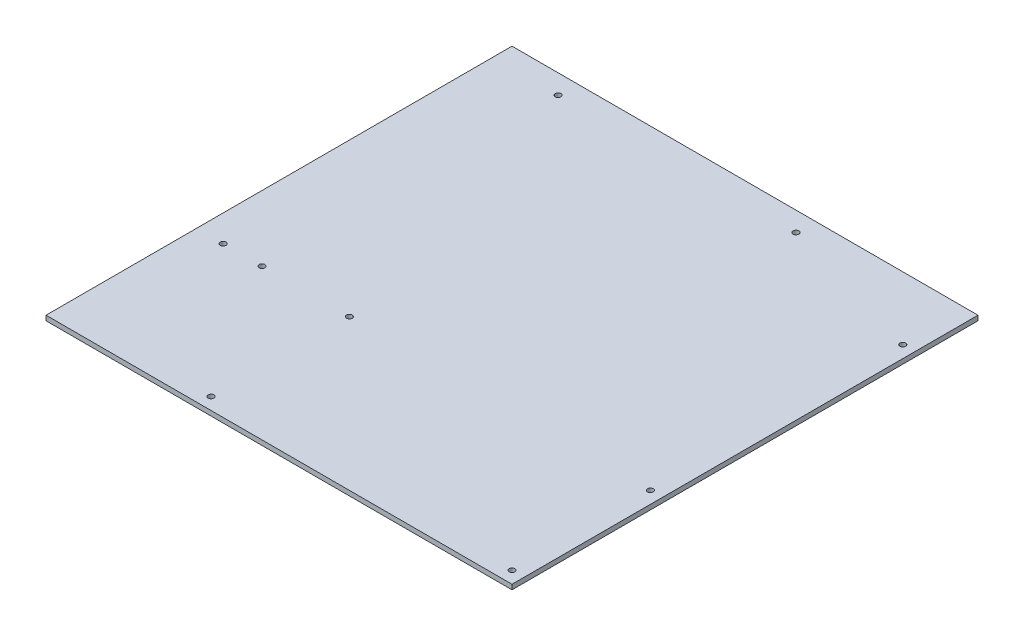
SolidWorks part; units mm, degrees
ref_plane "Спереди" through (0, 0, 0) normal (0, 0, 1) x (1, 0, 0)
ref_plane "Сверху" through (0, 0, 0) normal (0, 1, 0) x (1, 0, 0)
ref_plane "Справа" through (0, 0, 0) normal (1, 0, 0) x (0, 0, -1)
sketch "Sketch1" plane through (0, 0, 0) normal (0, 1, 0) x (1, 0, 0)
  line L1 (-121.92, 0) -> (121.92, 0)
  line L2 (-121.92, 0) -> (-121.92, 243.84)
  line L3 (-121.92, 243.84) -> (121.92, 243.84)
  line L4 (121.92, 0) -> (121.92, 243.84)
  dimension "D1" = 243.84
  dimension "D2" = 243.84
extrude "Extrude1" add sketch "Sketch1" along normal blind 2.54
hole_wizard "Ø3.0 (3) Diameter Hole1" positions "Sketch3" profile "Sketch2" hole size "Ø3.0" standard "ISO"
sketch "Sketch3" plane through (0, 2.54, 0) normal (0, 1, 0) x (1, 0, 0)
  line L0 (121.92, 243.84) -> (-121.92, 243.84) construction
  line L1 (-121.92, 243.84) -> (-121.92, 0) construction
  point P0 (-87.63, 233.68)
  point P6 (-41.91, 6.35)
  point P28 (36.83, 233.68)
  point P31 (115.57, 210.82)
  point P58 (-107.95, 78.74)
  point P66 (-87.63, 78.74)
  point P72 (-41.91, 78.74)
  point P75 (115.57, 6.35)
  point P77 (115.57, 78.74)
  dimension "D1" = 10.16
  dimension "D2" = 34.29
  dimension "D3" = 227.33
  dimension "D4" = 45.72
  dimension "D8" = 124.46
  dimension "D9" = 22.86
  dimension "D10" = 203.2
  dimension "D12" = 154.94
  dimension "D13" = 20.32
sketch "Sketch2" plane through (-87.63, 2.54, -233.68) normal (1, 0, 0) x (0, 0, 1)
  line L0 (0, 0) -> (0, 3.9493)
  line L1 (0, 3.9493) -> (1.5, 3.048)
  line L2 (1.5, 3.048) -> (1.5, 0)
  line L5 (1.5, 0) -> (0, 0)
  line L10 (0, 3.9493) -> (-1.5, 3.048) construction
  line L11 (0, -6.35) -> (0, 107.95) construction
  dimension "Hole Dia." = 3
  dimension "Hole Depth" = 3.048
  dimension "Drill Angle" = 118
